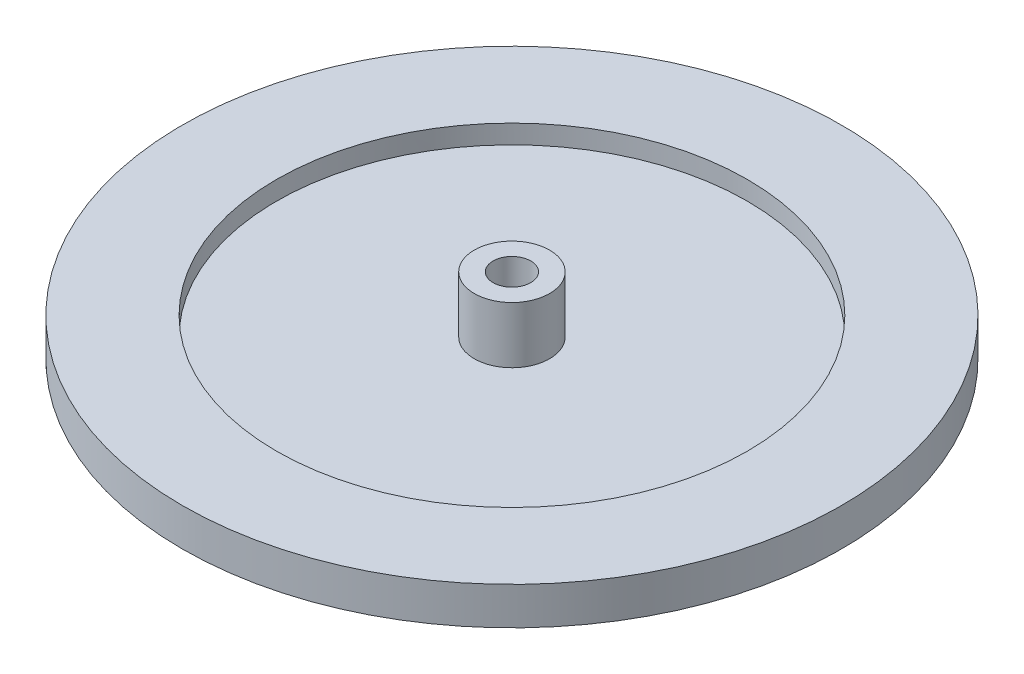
SolidWorks part; units mm, degrees
ref_plane "前视基准面" through (0, 0, 0) normal (0, 0, 1) x (1, 0, 0)
ref_plane "上视基准面" through (0, 0, 0) normal (0, 1, 0) x (1, 0, 0)
ref_plane "右视基准面" through (0, 0, 0) normal (1, 0, 0) x (0, 0, -1)
sketch "草图1" plane through (0, 0, 0) normal (0, 1, 0) x (1, 0, 0)
  circle A0 centre (0, 0) radius 25
  circle A1 centre (0, 0) radius 35
  dimension "D1" = 70
  dimension "D2" = 50
extrude "凸台-拉伸1" add sketch "草图1" along normal blind 4
sketch "草图3" plane through (0, 0, 0) normal (0, -1, 0) x (1, 0, 0)
  circle A0 centre (0, 0) radius 4
  circle A1 centre (0, 0) radius 6
  dimension "D1" = 8
  dimension "D2" = 12
extrude "凸台-拉伸2" add sketch "草图3" against normal blind 2 separate body
sketch "草图4" plane through (0, 0, 0) normal (0, -1, 0) x (1, 0, 0)
  line L0 (0, 0) -> (0, 25) construction
  circle A0 centre (0, 0) radius 25 construction
  circle A1 centre (0, 0) radius 4
  circle A2 centre (0, 0) radius 25
  point P7 (2, 0)
  point P8 (2, 25)
  point P9 (-2, 0)
  point P10 (-2, 25)
  point P25 (0, 0)
  dimension "D3" = 8
extrude "凸台-拉伸3" add sketch "草图4" against normal blind 2
sketch "草图6" plane through (0, 0, 0) normal (0, -1, 0) x (1, 0, 0)
  circle A0 centre (0, 0) radius 4
  circle A2 centre (0, 0) radius 2
  dimension "D1" = 4
extrude "凸台-拉伸4" add sketch "草图6" along normal blind 10 and the other way blind 8
sketch "草图7" plane through (0, -10, 0) normal (0, -1, 0) x (1, 0, 0)
  line L0 (0, 0) -> (0, 15.1653) construction
  line L1 (0.8, 3) -> (-0.8, 3)
  line L2 (-0.8, 3) -> (-0.8, 1.135)
  line L3 (-0.8, 1.135) -> (0.8, 1.135)
  line L4 (0.8, 3) -> (0.8, 1.135)
  point P3 (0, 0)
  point P10 (0, 1.135)
  point P11 (0, 3)
  dimension "D1" = 3
  dimension "D2" = 1.6
extrude "切除-拉伸3" cut sketch "草图7" against normal blind 10
